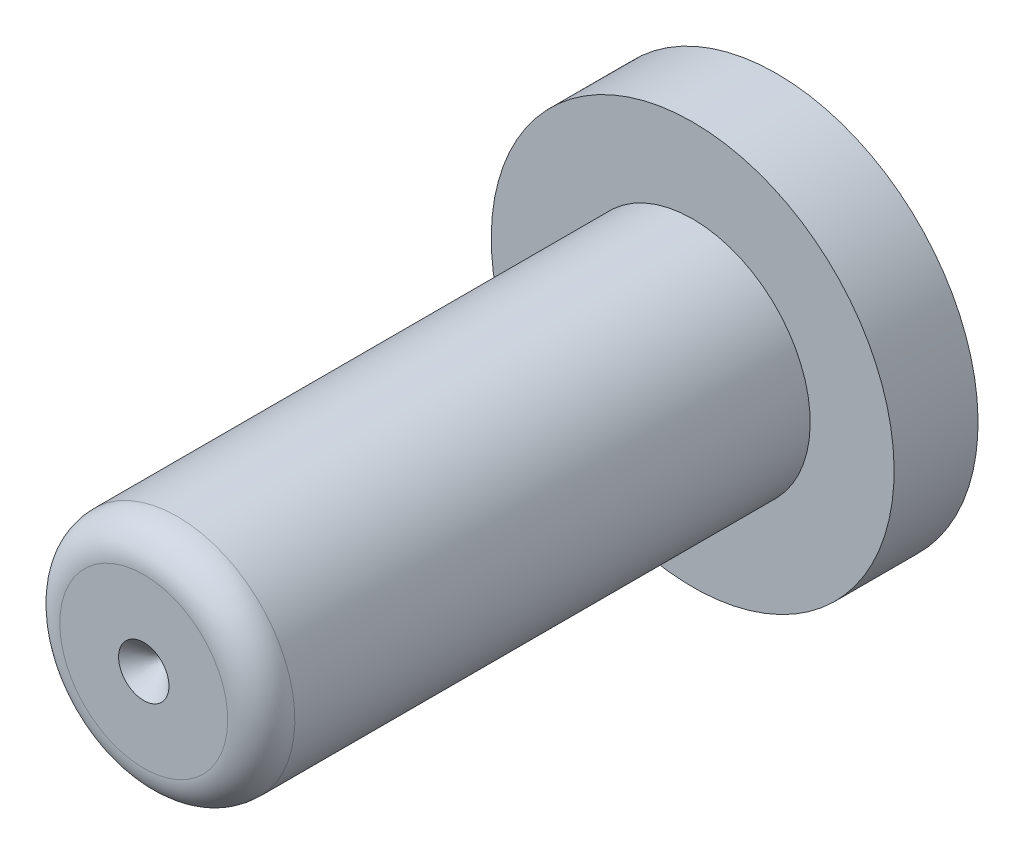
SolidWorks part; units mm, degrees
ref_plane "Front Plane" through (0, 0, 0) normal (0, 0, 1) x (1, 0, 0)
ref_plane "Top Plane" through (0, 0, 0) normal (0, 1, 0) x (1, 0, 0)
ref_plane "Right Plane" through (0, 0, 0) normal (1, 0, 0) x (0, 0, -1)
sketch "Sketch1" plane through (0, 0, 0) normal (1, 0, 0) x (0, 0, -1)
  line L0 (0, 0) -> (-36.2, 0) construction
  line L1 (0, 0) -> (0, 12)
  line L2 (0, 12) -> (-5, 12)
  line L3 (-5, 12) -> (-5, 7)
  line L4 (-5, 7) -> (-35.7, 7)
  line L5 (-37.7, 5) -> (-37.7, 1.5)
  line L6 (-37.7, 1.5) -> (-36.2, 0)
  line L7 (0, 0) -> (-36.2, 0)
  arc A0 (-35.7, 7) -> (-37.7, 5) centre (-35.7, 5) ccw
  dimension "D7" = 2
  dimension "D1" = 7
  dimension "D2" = 12
  dimension "D3" = 5
  dimension "D4" = 32.7
  dimension "D5" = 1.5
  dimension "D6" = 45
revolve "Revolve1" add sketch "Sketch1" angle 360 about L0
